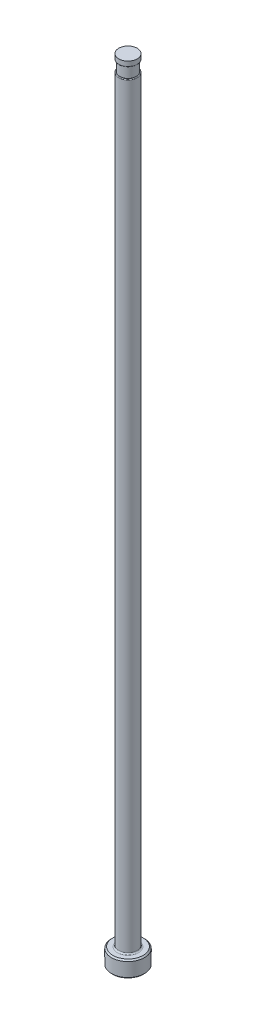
SolidWorks part; units mm, degrees
ref_plane "Front Plane" through (0, 0, 0) normal (0, 0, 1) x (1, 0, 0)
ref_plane "Top Plane" through (0, 0, 0) normal (0, 1, 0) x (1, 0, 0)
ref_plane "Right Plane" through (0, 0, 0) normal (1, 0, 0) x (0, 0, -1)
other "Configuration Table"
sketch "Sketch1" plane through (0, 0, 0) normal (0, 0, 1) x (1, 0, 0)
  line L0 (0, 259.9588) -> (0, -15.1925) construction
  line L1 (0, 0) -> (-3.175, 0)
  line L2 (-3.175, 0) -> (-3.175, 3.175)
  line L3 (-3.175, 3.175) -> (-1.7856, 3.175)
  line L4 (-1.7856, 3.175) -> (-1.7856, 152.4)
  line L5 (-1.7856, 152.4) -> (0, 152.4)
  line L6 (0, 152.4) -> (0, 0)
  dimension "L" = 152.4
  dimension "H" = 6.35
  dimension "T" = 3.175
  dimension "D" = 3.5712
revolve "Revolve1" add sketch "Sketch1" angle 360 about L0
chamfer "Chamfer1" distance 0.254 angle 45 2 edges at (0, 3.175, 3.175) (0, 0, 3.175)
fillet "Fillet1" radius 0.254 1 edges at (0, 3.175, 1.7856)
sketch "Sketch2" plane through (0, 0, 0) normal (0, 0, 1) x (1, 0, 0)
  line L0 (-1.7856, 152.4) -> (-1.7856, 3.429) construction
  line L1 (-1.7856, 151.384) -> (-1.5824, 151.384)
  line L2 (-1.7856, 151.384) -> (-1.7856, 149.352)
  line L3 (-1.7856, 149.352) -> (-1.5824, 149.352)
  line L4 (-1.5824, 151.384) -> (-1.5824, 149.352)
  line L5 (1.7856, 152.4) -> (-1.7856, 152.4) construction
  line L6 (0, 153.4483) -> (0, 147.3282) construction
  dimension "D1" = 2.032
  dimension "N" = 1.016
  dimension "FD" = 0.2032
  dimension "D3" = 3.1648
revolve "Vent Relief" cut sketch "Sketch2" angle 360 about L6
sketch "Sketch3" plane through (0, 0, 0) normal (0, 0, 1) x (1, 0, 0)
  line L0 (-1.5824, 150.368) -> (-1.5824, 86.868)
  line L1 (-1.5824, 151.384) -> (-1.5824, 149.352) construction
  line L2 (-1.7856, 149.352) -> (-1.7856, 3.429) construction
  line L3 (-1.7856, 85.7504) -> (-1.7856, 150.368)
  line L4 (-1.7856, 150.368) -> (-1.5824, 150.368)
  arc A0 (-1.5824, 86.868) -> (-1.7856, 85.7504) centre (-4.7574, 86.868) cw
  dimension "D1" = 3.175
  dimension "D2" = 63.5
extrude "D-Slot" cut sketch "Sketch3" against normal through all both and the other way through all
sketch "Sketch5" plane through (0, 0, 0) normal (0, 0, 1) x (1, 0, 0)
  line L0 (-1.7856, 151.384) -> (1.7856, 151.384) construction
  line L1 (-1.7856, 152.4) -> (-1.7805, 152.4)
  line L2 (-1.7856, 152.4) -> (-1.7856, 151.384)
  line L3 (-1.7856, 151.384) -> (-1.7805, 151.384)
  line L4 (-1.7805, 152.4) -> (-1.7805, 151.384)
  line L5 (0, 152.6877) -> (0, 150.5771) construction
  dimension "VP" = 0.0051
revolve "Vent Diameter" cut sketch "Sketch5" angle 360 about L5
fillet "Fillet2" radius 0.127 2 edges at (1.7856, 149.352, 0) (0, 151.384, 1.7805)
sketch "Pocket Sketch" plane through (0, 0, 0) normal (0, 0, 1) x (1, 0, 0)
  line L0 (-3.5719, 0) -> (-3.5719, 3.2004)
  line L1 (-3.5719, 3.2004) -> (-2.7461, 3.2004)
  line L2 (-1.9841, 3.9624) -> (-1.9841, 22.225)
  line L3 (-1.9841, 22.225) -> (0, 22.225)
  line L4 (0, 22.225) -> (0, 0)
  line L5 (0, 0) -> (-3.5719, 0)
  line L6 (0, 12.6104) -> (0, -2.4989) construction
  line L7 (-3.175, 2.921) -> (-3.175, 0.254) construction
  line L8 (2.921, 3.175) -> (-2.921, 3.175) construction
  line L9 (-1.7856, 85.7504) -> (-1.7856, 3.429) construction
  line L10 (-2.7461, 3.2004) -> (-1.9841, 3.9624)
  point P3 (-1.9841, 3.2004)
  dimension "D1" = 7.1437
  dimension "D2" = 0.3969
  dimension "D3" = 0.0254
  dimension "D4" = 0.1984
  dimension "D5" = 3.9681
  dimension "D6" = 22.225
